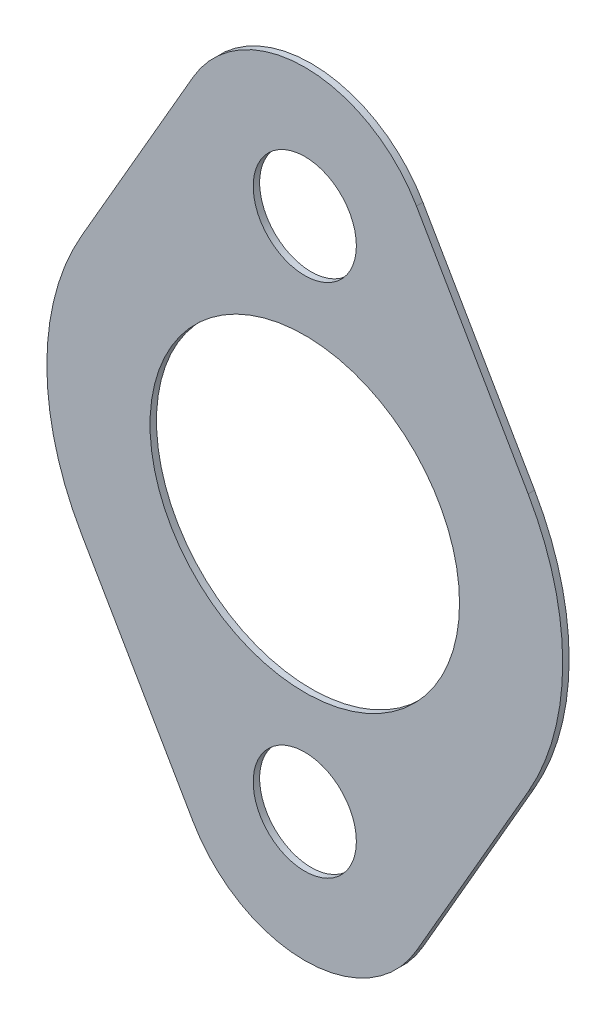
SolidWorks part; units mm, degrees
ref_plane "Front" through (0, 0, 0) normal (0, 0, 1) x (1, 0, 0)
ref_plane "Top" through (0, 0, 0) normal (0, 1, 0) x (1, 0, 0)
ref_plane "Right" through (0, 0, 0) normal (1, 0, 0) x (0, 0, -1)
sketch "Sketch1" plane through (0, 0, 0) normal (0, 0, 1) x (1, 0, 0)
  line L0 (0, 0) -> (0, 94.4945) construction
  line L1 (0, 0) -> (88.837, 0) construction
  line L2 (27.4963, 79.375) -> (54.9926, 31.75)
  line L3 (27.4963, -79.375) -> (54.9926, -31.75)
  line L4 (-27.4963, 79.375) -> (-54.9926, 31.75)
  line L5 (-27.4963, -79.375) -> (-54.9926, -31.75)
  arc A0 (-27.4963, 79.375) -> (27.4963, 79.375) centre (0, 63.5) cw
  arc A1 (-27.4963, -79.375) -> (27.4963, -79.375) centre (0, -63.5) ccw
  arc A2 (54.9926, 31.75) -> (54.9926, -31.75) centre (0, 0) cw
  arc A3 (-54.9926, -31.75) -> (-54.9926, 31.75) centre (0, 0) cw
  dimension "EndR" = 31.75
  dimension "SideR" = 63.5
  dimension "CtoC" = 127
extrude "Main" add sketch "Sketch1" along normal blind 1.5875
sketch "Sketch2" plane through (0, 0, 1.5875) normal (0, 0, 1) x (1, 0, 0)
  circle A0 centre (0, 63.5) radius 12.7
  circle A1 centre (0, -63.5) radius 12.7
  circle A2 centre (0, 0) radius 38.1
  dimension "BoltH" = 25.4
  dimension "CenterH" = 76.2
extrude "Holes" cut sketch "Sketch2" against normal through all
